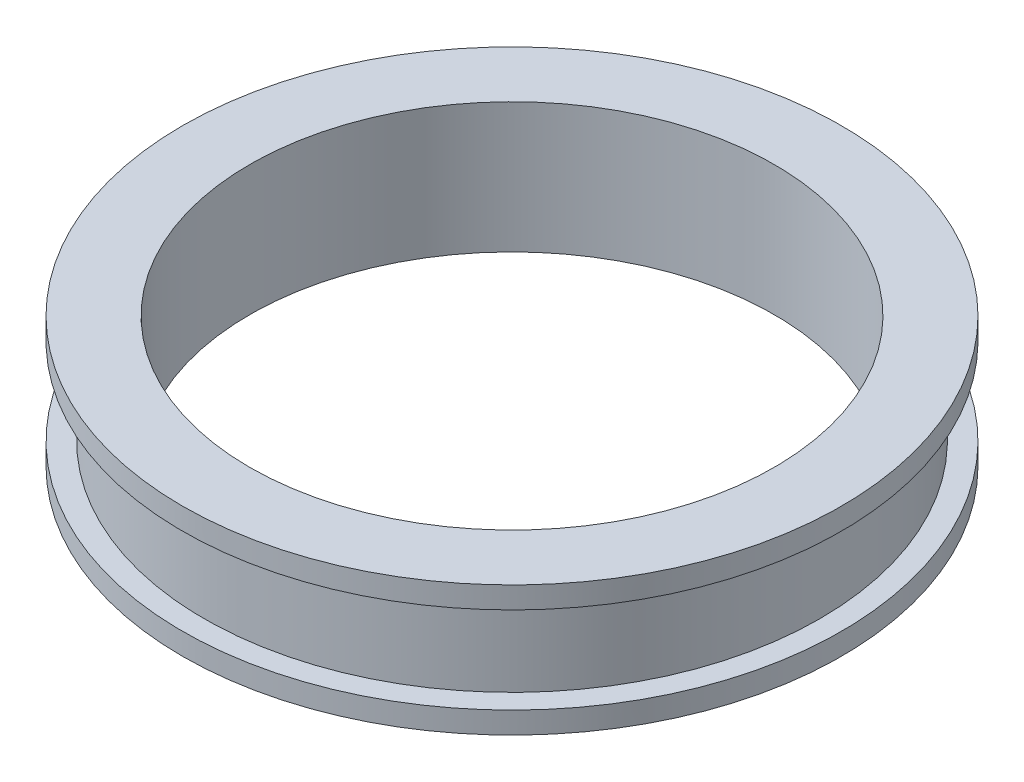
SolidWorks part; units mm, degrees
other "1/8"
ref_plane "Plane1" through (0, 0, 0) normal (0, 0, 1) x (1, 0, 0)
ref_plane "Plane2" through (0, 0, 0) normal (0, 1, 0) x (1, 0, 0)
ref_plane "Plane3" through (0, 0, 0) normal (1, 0, 0) x (0, 0, -1)
sketch "Sketch1" plane through (0, 0, 0) normal (0, 1, 0) x (1, 0, 0)
  circle A0 centre (0, 0) radius 76
  dimension "D1" = 152
extrude "Extrude1" add sketch "Sketch1" along normal blind 30
sketch "Sketch2" plane through (0, 30, 0) normal (0, 1, 0) x (-1, 0, 0)
  circle A0 centre (0, 0) radius 60.5
  dimension "D1" = 121
extrude "Cut-Extrude1" cut sketch "Sketch2" against normal through all
sketch "Sketch3" plane through (0, 0, 0) normal (0, 0, 1) x (1, 0, 0)
  line L0 (-87.7744, 15) -> (93.6179, 15) construction
  line L1 (-76, 0) -> (76, 0) construction
  line L2 (-76, 30) -> (-76, 0) construction
  line L3 (-76, 25) -> (-71, 25)
  line L4 (-76, 5) -> (-71, 5)
  line L5 (-71, 25) -> (-71, 5)
  line L6 (-76, 25) -> (-76, 5)
  line L7 (0, 69.9614) -> (0, -41.3583) construction
  dimension "D1" = 15
  dimension "D2" = 20
  dimension "D3" = 5
revolve "Cut-Revolve1" cut sketch "Sketch3" angle 360 about L7
fillet "rounds" [suppressed] radius 2
